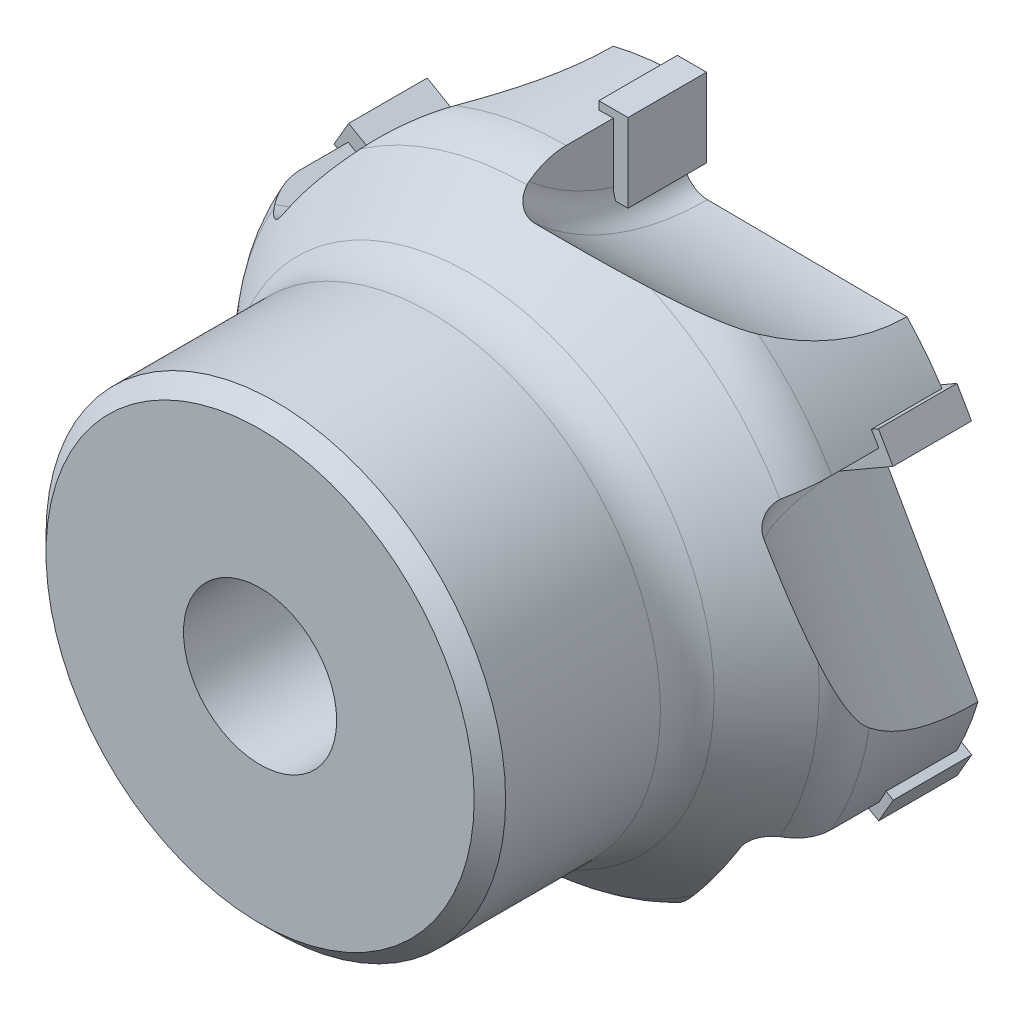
SolidWorks part; units mm, degrees
ref_plane "Face" through (0, 0, 0) normal (0, 0, 1) x (1, 0, 0)
ref_plane "Dessus" through (0, 0, 0) normal (0, 1, 0) x (1, 0, 0)
ref_plane "Droite" through (0, 0, 0) normal (1, 0, 0) x (0, 0, -1)
sketch "EsqCorps" plane through (0, 0, 0) normal (1, 0, 0) x (0, 0, -1)
  line L0 (-1, 11.75) -> (-1, 39)
  line L1 (-16, 39) -> (-1, 39)
  line L2 (-21.0137, 37.1751) -> (-28.2838, 31.0749)
  line L3 (-33.2975, 29.25) -> (-53, 29.25)
  line L4 (-55, 27.25) -> (-55, 9.75)
  line L5 (-55, 9.75) -> (-3, 9.75)
  line L6 (-3, 9.75) -> (-1, 11.75)
  line L9 (-53, 29.25) -> (-55, 27.25)
  line L10 (-1.4302, 0) -> (0.3881, 0) construction
  arc A0 (-28.2838, 31.0749) -> (-33.2975, 29.25) centre (-33.2975, 37.05) cw
  arc A1 (-16, 39) -> (-21.0137, 37.1751) centre (-16, 31.2) ccw
  point P19 (-55, 29.25)
  point P21 (-55, 29.25)
  dimension "CorpsCong" = 7.8
  dimension "D11" = 1
  dimension "R5m" = 29.25
  dimension "D4" = 135
  dimension "Rm" = 9.75
  dimension "D6" = 140
  dimension "D8" = 2
  dimension "Rc" = 39
  dimension "LU" = 15
  dimension "LT" = 54
revolve "CorpsOutil" add sketch "EsqCorps" angle 360 about L10
sketch "EsqGoujure" plane through (0, 0, 1) normal (0, 0, -1) x (-1, 0, 0)
  line L0 (0.03, 40) -> (0.03, 30)
  line L1 (-2.9462, 27.0001) -> (-29.7057, 26.7875)
  line L2 (-98.2893, 60) -> (109.7611, 60) construction
  line L3 (161.2705, 76.6199) -> (193.3626, 83.9085) construction
  arc A0 (0.03, 40) -> (-29.7057, 26.7875) centre (0, 0) ccw
  arc A1 (0.03, 30) -> (-2.9462, 27.0001) centre (-2.97, 30) cw
  circle A2 centre (0, 0) radius 39 construction
  dimension "CongGouj" = 3
  dimension "RayGouj" = 40
  dimension "ProfGouj" = 10
  dimension "TrajGouj" = 30
  dimension "D5" = 0.03
  dimension "AngGouj" = 48
revolve "Goujure" cut sketch "EsqGoujure" angle 90 about L2
sketch "EsqPlaquette" plane through (-0.03, 0, 0) normal (1, 0, 0) x (0, 0, -1)
  line L0 (-1, 30) -> (-1, 39) construction
  line L1 (-10, 30) -> (0, 30)
  line L2 (-10, 30) -> (-10, 40)
  line L3 (-10, 40) -> (0, 40)
  line L4 (0, 30) -> (0, 40)
  line L5 (-16, 39) -> (-1, 39) construction
  dimension "D1" = 1
  dimension "D2" = 1
  dimension "LU" = 10
  dimension "LU2" = 10
extrude "Plaquette" add sketch "EsqPlaquette" along normal blind 1.8587 and the other way blind 1.8587
ref_axis "Axe1" through (0, 0, -0.0974) along (0, 0, 1)
pattern_circular "Rep" count 6 every 60 about axis through (0, 0, -0.0974) along (0, 0, 1) of "Goujure"
pattern_circular "Rep_Plaquette" count 6 every 60 about axis through (0, 0, 0) along (0, 0, 1) of "Plaquette"
equation "\"Rm@EsqCorps\"=\"Rc@EsqCorps\"/4"
equation "\"R5m@EsqCorps\"=\"Rc@EsqCorps\"*3/4"
equation "\"CorpsCong@EsqCorps\" = \"Rc@EsqCorps\" / 5"
equation "\"LU@EsqCorps\"=\"LU@EsqPlaquette\"*1.5"
equation "\"LT@EsqCorps\" =  \"LU@EsqCorps\"+\"Rc@EsqCorps\""
equation "\"RayGouj@EsqGoujure\"=\"Rc@EsqCorps\"+1"
equation "\"TrajGouj@EsqGoujure\" =  \"LU@EsqCorps\"*2"
equation "\"AngGouj@EsqGoujure\"=\"AngRep@Rep\"*4/5"
equation "\"ProfGouj@EsqGoujure\" = \"LU2@EsqPlaquette\""
equation "\"DemiEpPos@Plaquette\" = \"LU@EsqPlaquette\"/(2.69*2)"
equation "\"DemiEpNeg@Plaquette\" = \"DemiEpPos@Plaquette\""
